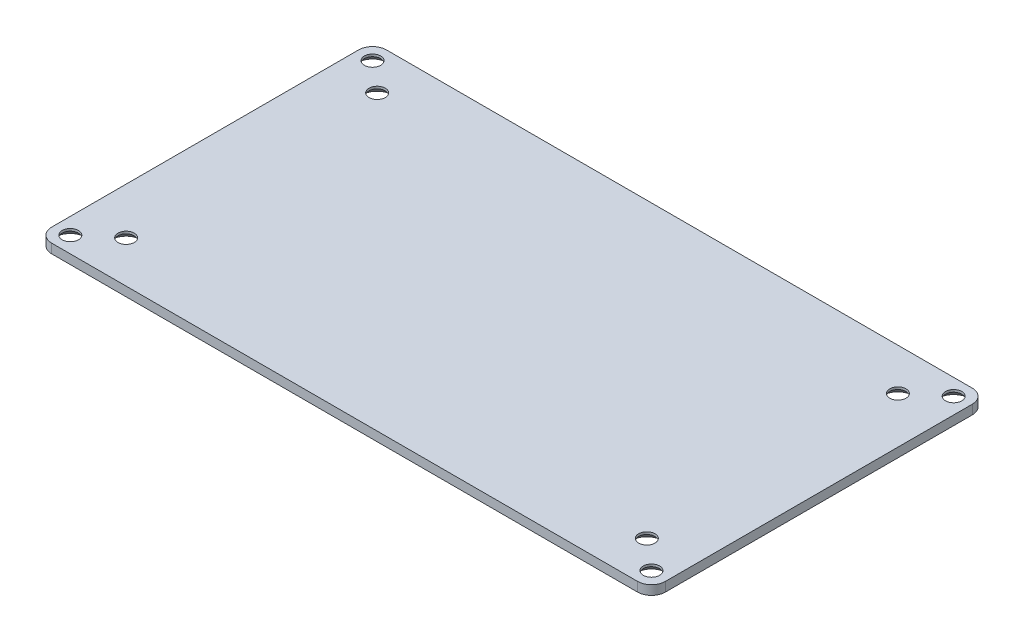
SolidWorks part; units mm, degrees
ref_plane "Спереди" through (0, 0, 0) normal (0, 0, 1) x (1, 0, 0)
ref_plane "Сверху" through (0, 0, 0) normal (0, 1, 0) x (1, 0, 0)
ref_plane "Справа" through (0, 0, 0) normal (1, 0, 0) x (0, 0, -1)
sketch "Эскиз1" plane through (0, 0, 0) normal (0, 1, 0) x (1, 0, 0)
  line L1 (-63, 36) -> (63, 36)
  line L2 (-66, 33) -> (-66, -33)
  line L3 (-63, -36) -> (63, -36)
  line L4 (66, 33) -> (66, -33)
  line L5 (-66, 36) -> (66, -36) construction
  line L6 (-66, -36) -> (66, 36) construction
  arc A0 (-66, -33) -> (-63, -36) centre (-63, -33) ccw
  arc A1 (63, -36) -> (66, -33) centre (63, -33) ccw
  arc A2 (63, 36) -> (66, 33) centre (63, 33) cw
  arc A3 (-63, 36) -> (-66, 33) centre (-63, 33) ccw
  point P0 (0, 0)
  dimension "D3" = 3
  dimension "D1" = 72
  dimension "D2" = 132
extrude "Бобышка-Вытянуть1" add sketch "Эскиз1" along normal blind 2
sketch "Эскиз2" plane through (0, 2, 0) normal (0, 1, 0) x (1, 0, 0)
  line L0 (0, 36) -> (0, 0) construction
  line L1 (63, 36) -> (-63, 36) construction
  line L2 (0, 0) -> (66, 0) construction
  line L3 (66, -33) -> (66, 33) construction
  line L5 (-62.5, 32.5) -> (62.5, 32.5) construction
  line L6 (-62.5, 32.5) -> (-62.5, -32.5) construction
  line L7 (-62.5, -32.5) -> (62.5, -32.5) construction
  line L8 (62.5, 32.5) -> (62.5, -32.5) construction
  line L9 (-62.5, 32.5) -> (62.5, -32.5) construction
  line L10 (-62.5, -32.5) -> (62.5, 32.5) construction
  circle A0 centre (-62.5, 32.5) radius 1.75
  circle A1 centre (62.5, 32.5) radius 1.75
  circle A2 centre (62.5, -32.5) radius 1.75
  circle A3 centre (-62.5, -32.5) radius 1.75
  point P12 (62.5, 0)
  point P13 (0, 32.5)
  dimension "D3" = 3.5
  dimension "D1" = 125
  dimension "D2" = 65
extrude "Вырез-Вытянуть1" cut sketch "Эскиз2" against normal through all
sketch "Эскиз3" plane through (0, 2, 0) normal (0, 1, 0) x (1, 0, 0)
  line L1 (-56, 27) -> (56, 27) construction
  line L2 (-56, 27) -> (-56, -27) construction
  line L3 (-56, -27) -> (56, -27) construction
  line L4 (56, 27) -> (56, -27) construction
  line L5 (-56, 27) -> (56, -27) construction
  line L6 (-56, -27) -> (56, 27) construction
  circle A0 centre (-56, 27) radius 1.75
  circle A1 centre (56, 27) radius 1.75
  circle A2 centre (56, -27) radius 1.75
  circle A3 centre (-56, -27) radius 1.75
  point P0 (0, 0)
  dimension "D3" = 3.5
  dimension "D1" = 112
  dimension "D2" = 54
extrude "Вырез-Вытянуть2" cut sketch "Эскиз3" against normal through all
chamfer "Фаска1" distance 1.5 angle 45 8 edges at (62.5, 0, -30.75) (62.5, 0, 34.25) (-62.5, 0, -30.75) (-62.5, 0, 34.25) (-56, 0, -25.25) (56, 0, -25.25) (56, 0, 28.75) (-56, 0, 28.75)
sketch "Эскиз4" plane through (0, 0, 0) normal (0, -1, 0) x (1, 0, 0)
  line L1 (-45, 25) -> (45, 25) construction
  line L2 (-45, 25) -> (-45, -25) construction
  line L3 (-45, -25) -> (45, -25) construction
  line L4 (45, 25) -> (45, -25) construction
  line L5 (-45, 25) -> (45, -25) construction
  line L6 (-45, -25) -> (45, 25) construction
  circle A0 centre (-45, 25) radius 6.25
  circle A1 centre (45, 25) radius 6.25
  circle A2 centre (-45, -25) radius 6.25
  circle A3 centre (45, -25) radius 6.25
  point P0 (0, 0)
  dimension "D3" = 12.5
  dimension "D1" = 90
  dimension "D2" = 50
extrude "Вырез-Вытянуть3" cut sketch "Эскиз4" against normal blind 1
sketch "Эскиз5" plane through (0, 0, 0) normal (0, -1, 0) x (1, 0, 0)
  line L0 (0, -36) -> (-66, -36) construction
  line L1 (63, -36) -> (-63, -36) construction
  line L2 (-66, 0) -> (-66, -36) construction
  line L3 (-66, -33) -> (-66, 33) construction
